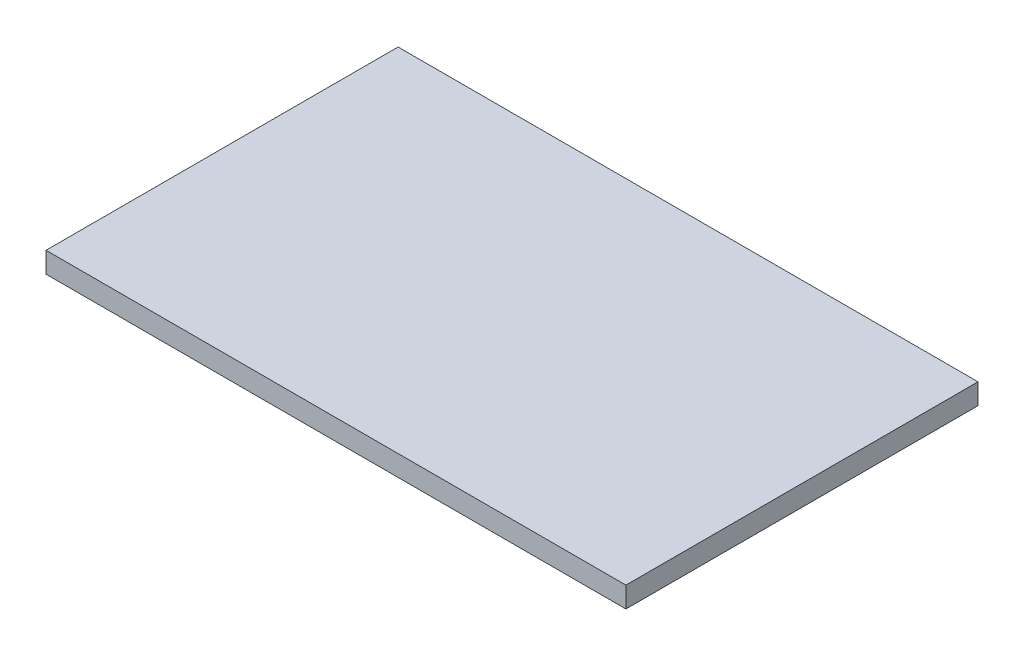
SolidWorks part; units mm, degrees
ref_plane "Face" through (0, 0, 0) normal (0, 0, 1) x (1, 0, 0)
ref_plane "Dessus" through (0, 0, 0) normal (0, 1, 0) x (1, 0, 0)
ref_plane "Droite" through (0, 0, 0) normal (1, 0, 0) x (0, 0, -1)
sketch "Esquisse1" plane through (0, 0, 0) normal (0, 1, 0) x (1, 0, 0)
  line L1 (0, 0) -> (14, 0)
  line L2 (0, 0) -> (0, -8.5)
  line L3 (0, -8.5) -> (14, -8.5)
  line L4 (14, 0) -> (14, -8.5)
  dimension "D1" = 14
  dimension "D2" = 8.5
extrude "Extrusion1" add sketch "Esquisse1" along normal blind 0.5
